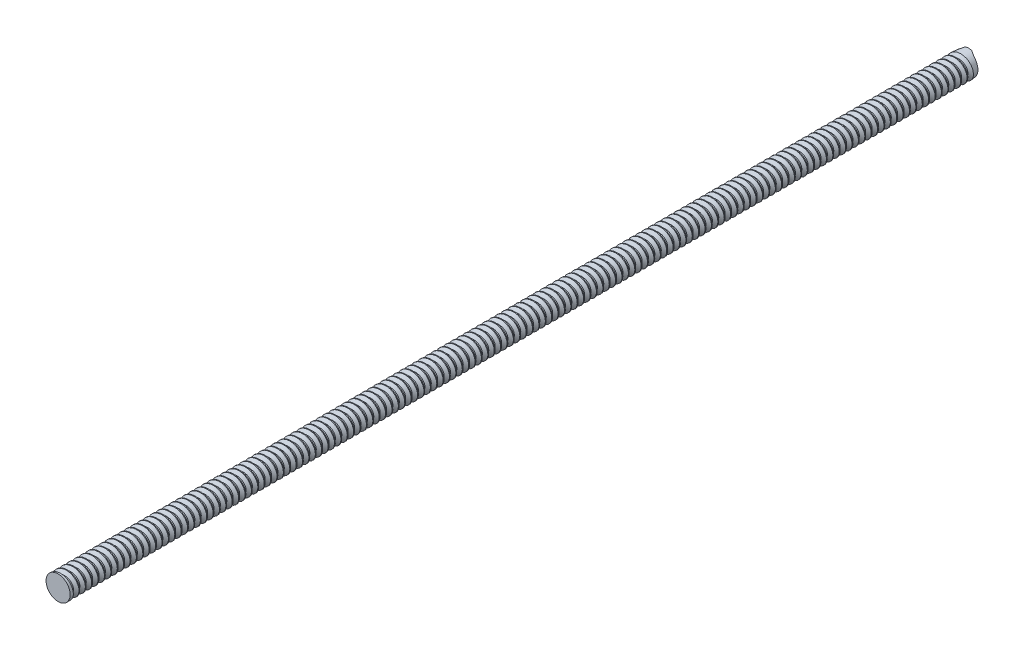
SolidWorks part; units mm, degrees
ref_plane "前视基准面" through (0, 0, 0) normal (0, 0, 1) x (1, 0, 0)
ref_plane "上视基准面" through (0, 0, 0) normal (0, 1, 0) x (1, 0, 0)
ref_plane "右视基准面" through (0, 0, 0) normal (1, 0, 0) x (0, 0, -1)
sketch "草图1" plane through (0, 0, 0) normal (0, 0, 1) x (1, 0, 0)
  circle A0 centre (0, 0) radius 4
extrude "凸台-拉伸1" add sketch "草图1" along normal blind 300
thread "螺纹线1" pitch 2.1167 start angle 0, offset 0, length 298, pitch 2.1167, diameter 8
ref_plane "基准面1" through (-4, 0, 300) normal (0, -1, 0) x (-1, 0, 0)
sketch "螺纹线轮廓1" plane through (-4, 0, 300) normal (0, -1, 0) x (-1, 0, 0)
  line L0 (0, 0) -> (0, 2.1167) construction
  line L11 (0, 0) -> (0, 1.8521)
  line L12 (0, 1.8521) -> (-1.1457, 1.1906)
  line L13 (-1.1457, 1.1906) -> (-1.1457, 0.6615)
  line L15 (-1.1457, 0.6615) -> (0, 0)
  line L17 (-1.1457, 0.926) -> (0, 0.926) construction
  point P2 (0, 0)
  dimension "Pitch" = 2.1167
  dimension "Profile_Angle" = 60
  dimension "Profile_Land" = 0.5292
  dimension "Profile_Height" = 1.1457
